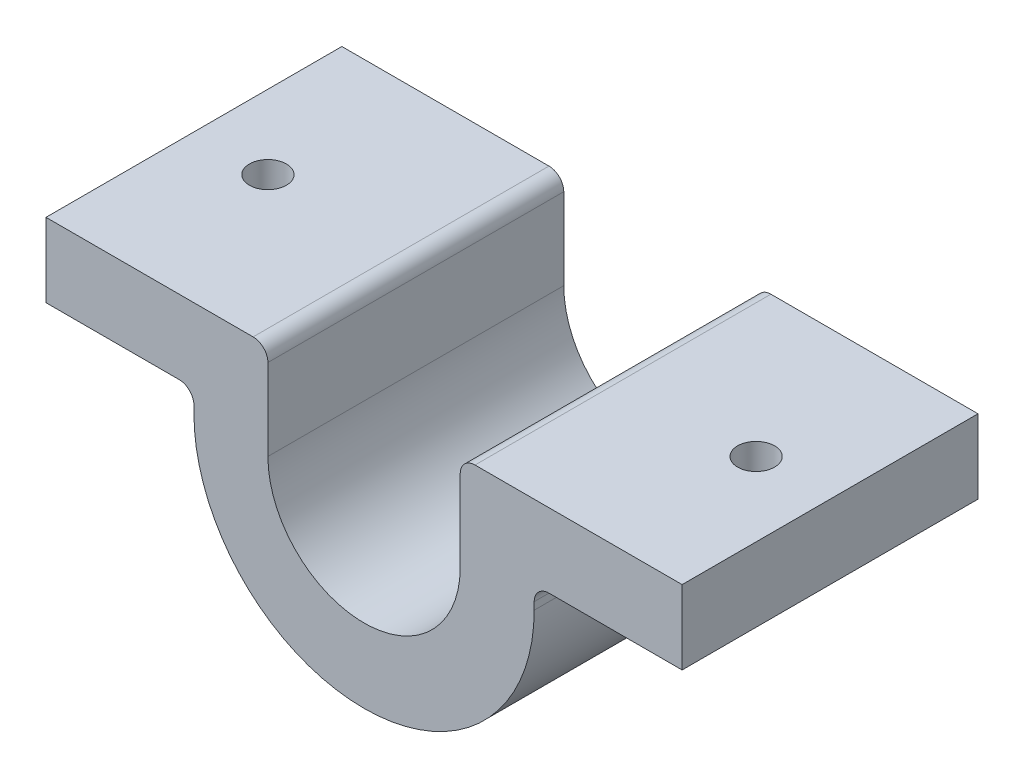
SolidWorks part; units mm, degrees
ref_plane "Front Plane" through (0, 0, 0) normal (0, 0, 1) x (1, 0, 0)
ref_plane "Top Plane" through (0, 0, 0) normal (0, 1, 0) x (1, 0, 0)
ref_plane "Right Plane" through (0, 0, 0) normal (1, 0, 0) x (0, 0, -1)
sketch "Sketch1" plane through (0, 0, 0) normal (0, 0, 1) x (1, 0, 0)
  line L0 (-6.5, 6.5) -> (-21.5, 6.5)
  line L1 (-28.1035, 6.5) -> (-28.1035, 2.4575)
  line L2 (6.5, 6.5) -> (21.5, 6.5)
  line L3 (-6.5, 0) -> (-6.5, 6.5)
  line L4 (11.5, 1.5) -> (21.5, 1.5)
  line L5 (11.5, 0) -> (11.5, 1.5)
  line L6 (6.5, 0) -> (6.5, 6.5)
  line L7 (-11.5, 0) -> (-11.5, 1.5)
  line L8 (-11.5, 1.5) -> (-21.5, 1.5)
  line L9 (-21.5, 6.5) -> (-21.5, 1.5)
  line L10 (21.5, 6.5) -> (21.5, 1.5)
  arc A0 (-6.5, 0) -> (6.5, 0) centre (0, 0) ccw
  arc A1 (-11.5, 0) -> (11.5, 0) centre (0, 0) ccw
  dimension "D1" = 13
  dimension "D2" = 15
  dimension "D3" = 5
extrude "Boss-Extrude1" add sketch "Sketch1" against normal blind 20 contours L7 A1 L5 L4 L10 L2 L6 A0 L3 L0 L9 L8
sketch "Sketch2" plane through (0, 1.5, 0) normal (0, -1, 0) x (-1, 0, 0)
  line L0 (11.5, 0) -> (21.5, 0) construction
  line L1 (21.5, 20) -> (21.5, 0) construction
  line L2 (-11.5, 0) -> (-21.5, 0) construction
  circle A0 centre (16.5, 10) radius 1.25
  circle A1 centre (-16.5, 10) radius 1.25
  point P4 (0, 0)
  point P7 (16.5, 0)
  point P8 (0, 0)
  point P11 (21.5, 10)
  point P12 (0, 0)
  point P13 (0, 0)
  point P16 (-16.5, 0)
  dimension "D1" = 2.5
extrude "Cut-Extrude1" cut sketch "Sketch2" against normal blind 20
fillet "Fillet1" radius 1 4 edges at (6.5, 6.5, -10) (11.5, 1.5, -10) (-6.5, 6.5, -10) (-11.5, 1.5, -10)
